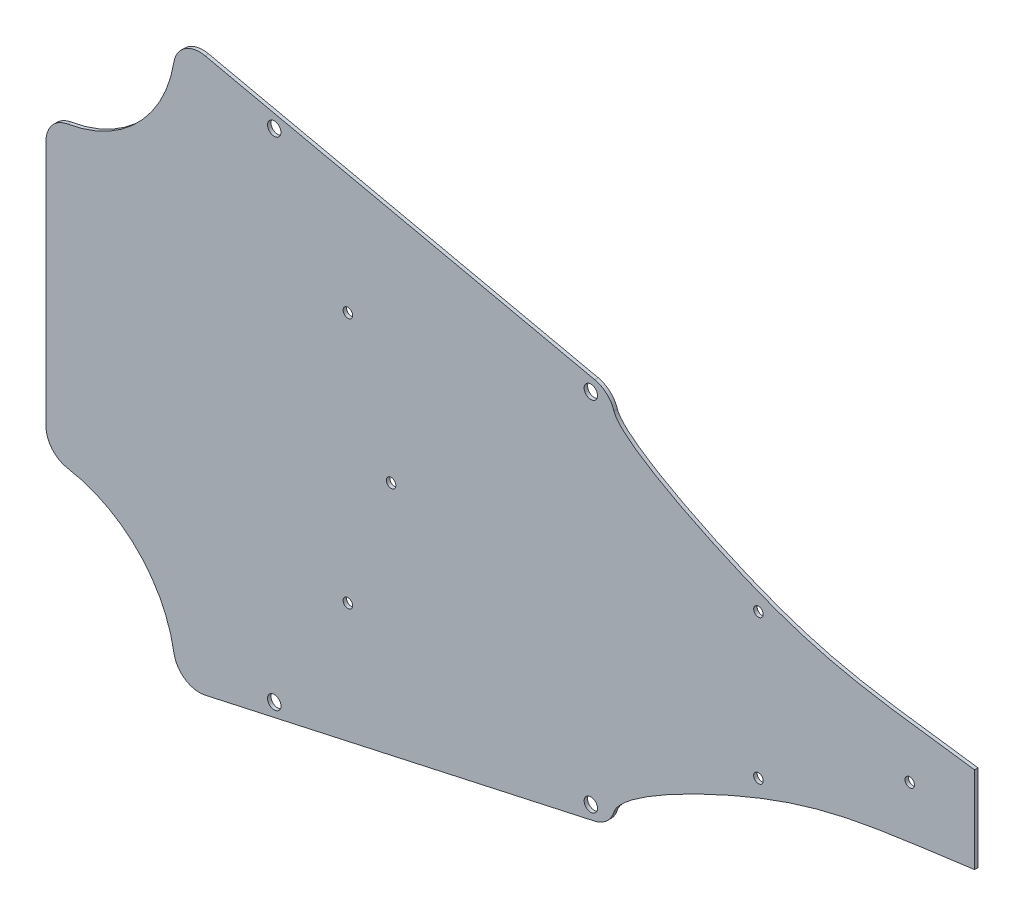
SolidWorks part; units mm, degrees
ref_plane "Plan de face" through (0, 0, 0) normal (0, 0, 1) x (1, 0, 0)
ref_plane "Plan de dessus" through (0, 0, 0) normal (0, 1, 0) x (1, 0, 0)
ref_plane "Plan de droite" through (0, 0, 0) normal (1, 0, 0) x (0, 0, -1)
sketch "Esquisse1" plane through (0, 0, 0) normal (0, 0, 1) x (1, 0, 0)
  line L0 (-5.9651, 0) -> (289.2459, 0) construction
  line L1 (0, 92.9067) -> (0, -65.7395) construction
  line L2 (240, 27.2953) -> (240, -49.3367) construction
  line L3 (235.0104, 10) -> (266.2783, 10) construction
  line L4 (190, 37.2908) -> (190, 8.3296) construction
  line L5 (151.4178, 47.9562) -> (151.4178, 31.9439) construction
  line L6 (156.4178, 47.9562) -> (156.4178, 31.9439) construction
  line L7 (145.1918, 42.3156) -> (161.4566, 42.3156) construction
  line L8 (77.9646, 57.4689) -> (151.4178, 41.3156) construction
  line L9 (50, 78.0416) -> (50, 0) construction
  line L10 (29.7186, 35) -> (59.7051, 35) construction
  line L11 (146.8802, 41.3156) -> (162.0757, 41.3156) construction
  line L12 (11.2531, 0) -> (36.1654, 0) construction
  line L13 (25.1505, 91.0913) -> (25.1505, 10) construction
  line L14 (30, 12.412) -> (30, -14.7132) construction
  line L15 (15.6126, 74) -> (37.7434, 74) construction
  line L16 (25.1505, 28.5698) -> (25.1505, -28.5698)
  line L17 (61.9581, -64.0606) -> (152.1313, -44.2303)
  line L20 (240, 10) -> (240, -10)
  line L22 (40.7677, 68.7207) -> (239.6066, 24.9934) construction
  line L23 (18.2919, 84.0663) -> (34.0867, 84.0663) construction
  line L24 (61.9581, 64.0606) -> (152.1313, 44.2303)
  line L28 (225, 6.545) -> (225, -7.5044) construction
  line L29 (105, 13.9669) -> (105, -11.5576) construction
  line L30 (240, 10) -> (50, 35) construction
  line L31 (95, 40.4284) -> (95, 18.8854) construction
  line L32 (190, 22.4382) -> (190, 10) construction
  line L35 (71.8037, 60) -> (90.5861, 60) construction
  line L37 (15.6126, 64) -> (37.7434, 64) construction
  circle A0 centre (25.1505, 84.0663) radius 45 construction
  arc A1 (0, 88.473) -> (0, 39.6597) centre (25.1505, 64.0663) ccw construction
  circle A2 centre (151.2142, 41.3603) radius 1.55
  arc A3 (61.9581, 64.0606) -> (54.7496, 59.1783) centre (60.6694, 58.2007) ccw
  arc A4 (30.1505, 34.4859) -> (54.7496, 59.1783) centre (25.1505, 64.0663) ccw
  arc A5 (30.1505, 34.4859) -> (25.1505, 28.5698) centre (31.1505, 28.5698) ccw
  arc A6 (152.1313, 44.2303) -> (156.556, 40.2028) centre (150.8426, 38.3704) cw
  arc A7 (69.8682, 79.0332) -> (0, 36.6844) centre (25.1505, 74) ccw construction
  arc A8 (27.0449, 29.0714) -> (60.0557, 60.9256) centre (25.1505, 64.0663) ccw construction
  circle A9 centre (151.2142, -41.3603) radius 1.55
  arc A10 (152.1313, -44.2303) -> (156.556, -40.2028) centre (150.8426, -38.3704) ccw
  arc A11 (30.1505, -34.4859) -> (25.1505, -28.5698) centre (31.1505, -28.5698) cw
  arc A12 (30.1505, -34.4859) -> (54.7496, -59.1783) centre (25.1505, -64.0663) cw
  circle A13 centre (225, 0) radius 1.1
  circle A14 centre (105, 0) radius 1.1
  circle A15 centre (190, 16.6831) radius 1.1
  circle A16 centre (95, 29.0789) radius 1.1
  circle A17 centre (190, -16.6831) radius 1.1
  circle A18 centre (95, -29.0789) radius 1.1
  arc A19 (61.9581, -64.0606) -> (54.7496, -59.1783) centre (60.6694, -58.2007) cw
  circle A20 centre (77.9646, -57.4689) radius 1.55
  circle A22 centre (77.9646, 57.4689) radius 1.55
  spline S0 degree 3 poles (240, 10) (216.274, 13.2295) (198.7842, 14.4819) (158.0149, 35.6539) (156.556, 40.2028) knots 0 0 0 0 0.573688 0.920874 0.920874 0.920874 0.920874
  spline S1 degree 3 poles (240, -10) (216.274, -13.2295) (198.7842, -14.4819) (158.0149, -35.6539) (156.556, -40.2028) knots 0 0 0 0 0.573688 0.920874 0.920874 0.920874 0.920874
  point P42 (55.1316, 65.1303)
  point P61 (70.1499, 83.8306)
  point P69 (240, 0)
  point P99 (25.1505, 0)
  point P115 (60.1038, 65.8072)
  dimension "D1" = 75
  dimension "D2" = 5
  dimension "D3" = 3
  dimension "D4" = 6
  dimension "D5" = 6
  dimension "D6" = 6
extrude "Extrusion1" add sketch "Esquisse1" along normal blind 0.8
sketch "Esquisse2" plane through (0, 0, 0.8) normal (0, 0, 1) x (1, 0, 0)
  line L0 (-10.1186, 0) -> (255.56, 0) construction
  line L1 (157.7597, -13.9988) -> (133.7052, -55.4498) construction
  line L2 (61.9581, -64.0606) -> (148.5599, -45.0157) construction
  line L3 (191.1, 16.6831) -> (74.3906, 31.7373) construction
  line L4 (61.9581, -64.0606) -> (152.1313, -44.2303) construction
  line L5 (58.6607, -56.5946) -> (155.7443, -35.2446) construction
  line L6 (95, -29.0789) -> (190, -16.6831) construction
  line L7 (177.5769, -23.3465) -> (63.3181, -38.2553) construction
  line L8 (147.7597, -13.9988) -> (123.7052, -55.4498) construction
  line L9 (137.7597, -13.9988) -> (113.7052, -55.4498) construction
  line L10 (60.3867, 22.9206) -> (16.5928, -52.5456) construction
  line L11 (-1.5475, -25) -> (71.8968, -25) construction
  line L12 (138.0538, -27.5543) -> (131.116, -39.5914)
  line L13 (148.9266, -26.1319) -> (142.5811, -37.0666)
  line L14 (140.7396, -29.1023) -> (133.8018, -41.1394)
  line L15 (127.1595, -28.9803) -> (119.6503, -42.117)
  line L16 (151.6079, -27.6879) -> (145.2623, -38.6226)
  line L17 (4.2891, -8) -> (63.3181, -8) construction
  line L18 (129.8509, -30.5187) -> (122.3417, -43.6555)
  line L19 (127.1595, 28.9803) -> (119.6503, 42.117)
  line L20 (105.0672, 0) -> (80.0672, 43.3013) construction
  line L21 (105.0672, 0) -> (96.407, 15)
  line L22 (105.0672, 0) -> (96.407, -15)
  line L23 (35, 0) -> (29.2831, 34.2655) construction
  line L24 (42.5778, -25) -> (52.4431, -8) construction
  line L25 (52.5778, -25) -> (62.4431, -8) construction
  line L26 (33.9184, -25.778) -> (43.7837, -8.778)
  line L27 (50, 0) -> (44.5318, 32.775) construction
  line L28 (43.9184, -25.778) -> (53.7837, -8.778)
  line L29 (53.9184, -25.778) -> (63.7837, -8.778) construction
  line L30 (31.2372, -24.222) -> (41.1025, -7.222)
  line L31 (41.2372, -24.222) -> (51.1025, -7.222)
  line L32 (51.2372, -24.222) -> (61.1025, -7.222) construction
  line L33 (140.7396, 29.1023) -> (133.8018, 41.1394)
  line L34 (138.0538, 27.5543) -> (131.116, 39.5914)
  line L35 (148.9266, 26.1319) -> (142.5811, 37.0666)
  line L36 (151.6079, 27.6879) -> (145.2623, 38.6226)
  line L37 (33.9184, 25.778) -> (43.7837, 8.778)
  line L38 (31.2372, 24.222) -> (41.1025, 7.222)
  line L39 (43.9184, 25.778) -> (53.7837, 8.778)
  line L40 (41.2372, 24.222) -> (51.1025, 7.222)
  line L41 (51.2372, 24.222) -> (61.1025, 7.222) construction
  line L42 (53.9184, 25.778) -> (63.7837, 8.778) construction
  line L43 (129.8509, 30.5187) -> (122.3417, 43.6555)
  arc A0 (148.9266, -26.1319) -> (151.6079, -27.6879) centre (150.2672, -26.9099) cw
  arc A1 (142.5811, -37.0666) -> (145.2623, -38.6226) centre (143.9217, -37.8446) ccw
  arc A2 (131.116, -39.5914) -> (133.8018, -41.1394) centre (132.4589, -40.3654) ccw
  arc A3 (140.7396, -29.1023) -> (138.0538, -27.5543) centre (139.3967, -28.3283) ccw
  arc A4 (129.8509, -30.5187) -> (127.1595, -28.9803) centre (128.5052, -29.7495) ccw
  arc A5 (119.6503, -42.117) -> (122.3417, -43.6555) centre (120.996, -42.8863) ccw
  arc A6 (41.1025, -7.222) -> (43.7837, -8.778) centre (42.4431, -8) cw
  arc A7 (51.1025, -7.222) -> (53.7837, -8.778) centre (52.4431, -8) cw
  arc A8 (61.1025, -7.222) -> (63.7837, -8.778) centre (62.4431, -8) cw construction
  arc A9 (53.9184, -25.778) -> (51.2372, -24.222) centre (52.5778, -25) cw construction
  arc A10 (43.9184, -25.778) -> (41.2372, -24.222) centre (42.5778, -25) cw
  arc A11 (33.9184, -25.778) -> (31.2372, -24.222) centre (32.5778, -25) cw
  arc A12 (119.6503, 42.117) -> (122.3417, 43.6555) centre (120.996, 42.8863) cw
  arc A13 (96.407, 15) -> (96.407, -15) centre (89.6766, 0) ccw
  arc A14 (131.116, 39.5914) -> (133.8018, 41.1394) centre (132.4589, 40.3654) cw
  arc A15 (142.5811, 37.0666) -> (145.2623, 38.6226) centre (143.9217, 37.8446) cw
  arc A16 (148.9266, 26.1319) -> (151.6079, 27.6879) centre (150.2672, 26.9099) ccw
  arc A17 (33.9184, 25.778) -> (31.2372, 24.222) centre (32.5778, 25) ccw
  arc A18 (41.1025, 7.222) -> (43.7837, 8.778) centre (42.4431, 8) ccw
  arc A19 (51.1025, 7.222) -> (53.7837, 8.778) centre (52.4431, 8) ccw
  arc A20 (43.9184, 25.778) -> (41.2372, 24.222) centre (42.5778, 25) ccw
  arc A21 (53.9184, 25.778) -> (51.2372, 24.222) centre (52.5778, 25) ccw construction
  arc A22 (61.1025, 7.222) -> (63.7837, 8.778) centre (62.4431, 8) ccw construction
  arc A23 (129.8509, 30.5187) -> (127.1595, 28.9803) centre (128.5052, 29.7495) cw
  arc A24 (140.7396, 29.1023) -> (138.0538, 27.5543) centre (139.3967, 28.3283) cw
  dimension "D7" = 60
  dimension "D8" = 15
  dimension "D1" = 8
  dimension "D2" = 5
  dimension "D3" = 1.55
  dimension "D4" = 1.55
sketch "Esquisse3" plane through (0, 0, 0.8) normal (0, 0, 1) x (1, 0, 0)
  line L0 (150.1399, 41.5966) -> (152.2886, 41.1241)
  line L1 (69.2496, 62.4571) -> (158.3599, 42.8606) construction
  line L2 (152.1313, 44.2303) -> (61.9581, 64.0606) construction
  line L3 (152.8862, 54.0845) -> (155.0348, 53.612)
  line L4 (79.0389, 57.2327) -> (81.393, 67.9375)
  line L5 (152.2886, 41.1241) -> (155.0348, 53.612)
  line L6 (76.8902, 57.7052) -> (79.2444, 68.41)
  line L7 (150.1399, 41.5966) -> (152.8862, 54.0845)
  line L8 (79.2444, 68.41) -> (81.393, 67.9375)
  line L9 (76.8902, 57.7052) -> (79.0389, 57.2327)
  line L10 (8.5988, 0) -> (233.4394, 0) construction
  line L11 (76.8902, -57.7052) -> (79.0389, -57.2327)
  line L12 (79.2444, -68.41) -> (81.393, -67.9375)
  line L13 (76.8902, -57.7052) -> (79.2444, -68.41)
  line L14 (79.0389, -57.2327) -> (81.393, -67.9375)
  line L15 (150.1399, -41.5966) -> (152.8862, -54.0845)
  line L16 (152.2886, -41.1241) -> (155.0348, -53.612)
  line L17 (152.8862, -54.0845) -> (155.0348, -53.612)
  line L18 (150.1399, -41.5966) -> (152.2886, -41.1241)
